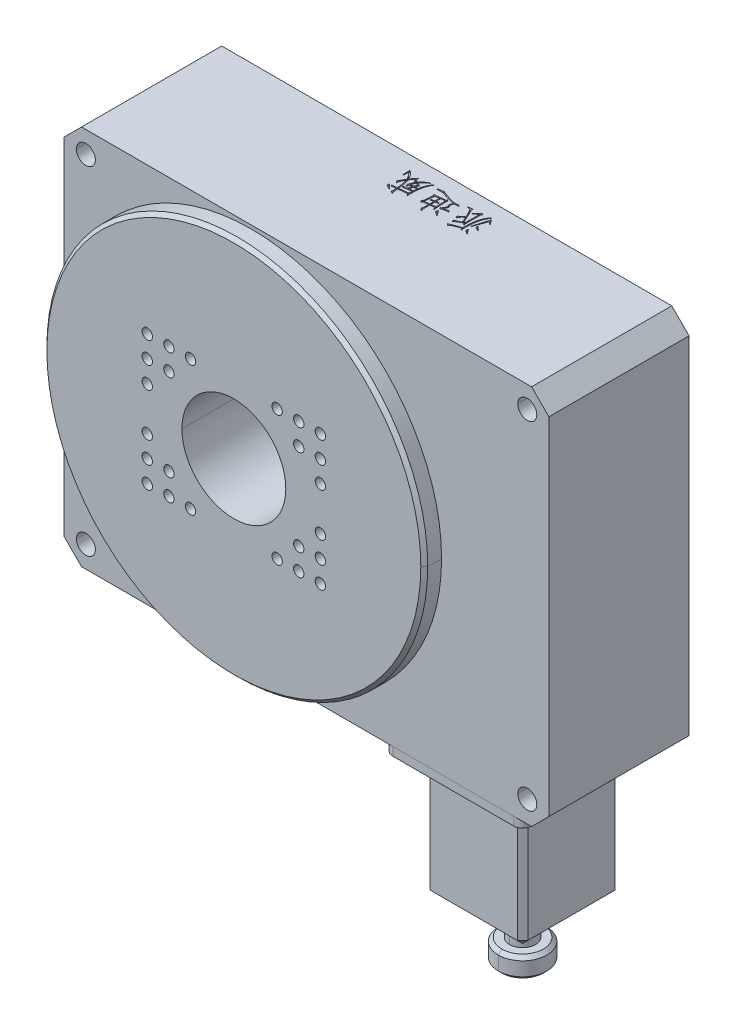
SolidWorks part; units mm, degrees
ref_plane "前视基准面" through (0, 0, 0) normal (0, 0, 1) x (1, 0, 0)
ref_plane "上视基准面" through (0, 0, 0) normal (0, 1, 0) x (1, 0, 0)
ref_plane "右视基准面" through (0, 0, 0) normal (1, 0, 0) x (0, 0, -1)
imported_body "输入1"
sketch "草图2" plane through (0, 43.1212, 0) normal (0, 1, 0) x (1, 0, 0)
  line L0 (44.4085, -9.7193) -> (177.6299, -9.7193) construction
  text T0 "派迪威" font "仿宋" height 12
extrude "切除-拉伸1" cut sketch "草图2" against normal blind 1
